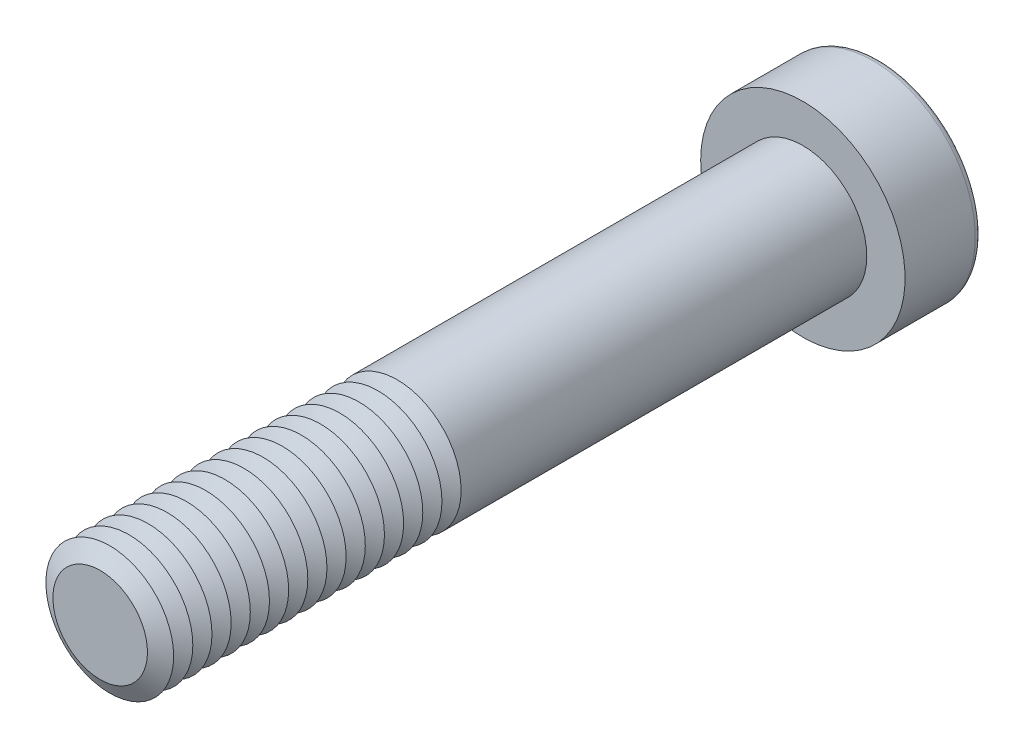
SolidWorks part; units mm, degrees
ref_plane "Front Plane" through (0, 0, 0) normal (0, 0, 1) x (1, 0, 0)
ref_plane "Top Plane" through (0, 0, 0) normal (0, 1, 0) x (1, 0, 0)
ref_plane "Right Plane" through (0, 0, 0) normal (1, 0, 0) x (0, 0, -1)
sketch "Sketch1" plane through (0, 0, 0) normal (0, 0, 1) x (1, 0, 0)
  circle A0 centre (0, 0) radius 5
  dimension "D1" = 10
extrude "Boss-Extrude1" add sketch "Sketch1" along normal blind 55
sketch "Sketch2" plane through (0, 0, 0) normal (0, 0, -1) x (-1, 0, 0)
  circle A0 centre (0, 0) radius 8
  dimension "D1" = 16
extrude "Boss-Extrude2" add sketch "Sketch2" along normal blind 6
sketch "Sketch3" plane through (0, 0, -6) normal (0, 0, -1) x (-1, 0, 0)
  line L1 (-2.0207, 3.5) -> (-4.0415, 0)
  line L2 (-4.0415, 0) -> (-2.0207, -3.5)
  line L3 (-2.0207, -3.5) -> (2.0207, -3.5)
  line L4 (2.0207, -3.5) -> (4.0415, 0)
  line L5 (4.0415, 0) -> (2.0207, 3.5)
  line L6 (2.0207, 3.5) -> (-2.0207, 3.5)
  circle A0 centre (0, 0) radius 3.5 construction
  dimension "D1" = 7
extrude "Cut-Extrude1" cut sketch "Sketch3" against normal blind 5.25
fillet "Fillet1" radius 0.5 1 edges at (-8, 0, -6)
sketch "Sketch4" plane through (0, 0, -0.75) normal (0, 0, -1) x (-1, 0, 0)
  line L0 (2.0207, -3.5) -> (4.0415, 0) construction
  circle A0 centre (0, 0) radius 3.5
extrude "Cut-Extrude2" cut sketch "Sketch4" against normal through all draft 60
sketch "Sketch5" plane through (0, 0, -6) normal (0, 0, -1) x (-1, 0, 0)
  circle A0 centre (0, 0) radius 4.0415
extrude "Cut-Extrude3" cut sketch "Sketch5" against normal through all draft 75
sketch "Sketch7" plane through (0, 0, 0) normal (1, 0, 0) x (0, 0, -1)
  line L25 (-55, 3.701) -> (-54.25, 5)
  line L26 (-55, 5) -> (-55, -5) construction
  line L27 (-54.25, 5) -> (-55.75, 5)
  line L28 (-55.75, 5) -> (-55, 3.701)
  line L29 (0, 5) -> (-55, 5) construction
  dimension "D1" = 1.5
revolve "Cut-Revolve1" cut sketch "Sketch7" angle 360 about axis through (0, 0, 55) along (0, 0, -1)
pattern_linear "LPattern1" count 16 spacing 1.5 along (0, 0, -1) of "Cut-Revolve1"
